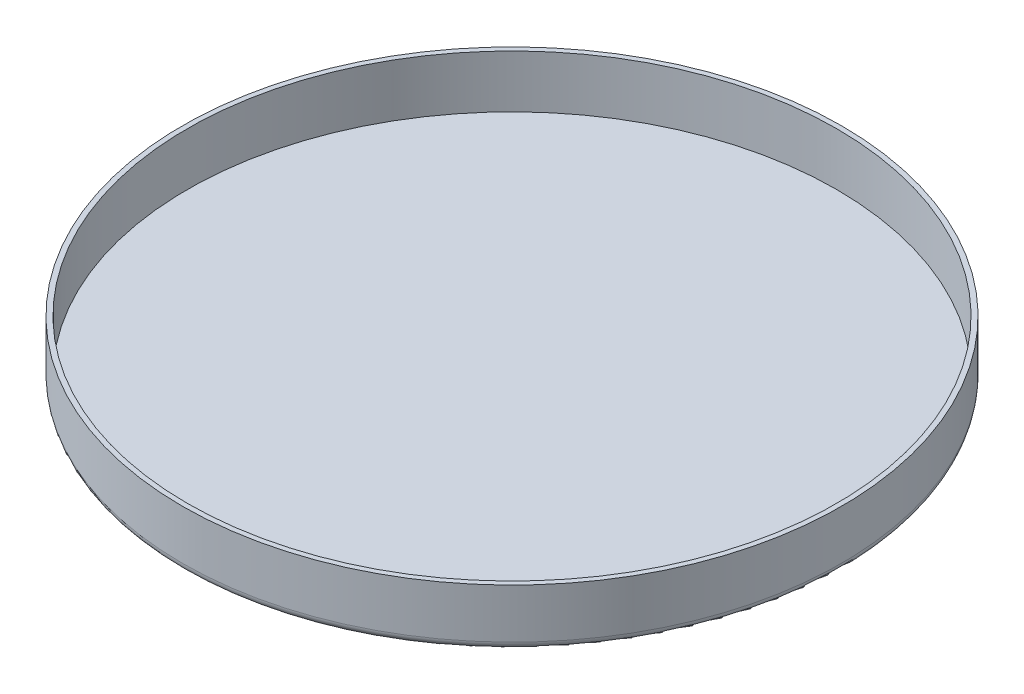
SolidWorks part; units mm, degrees
ref_plane "Plano frontal" through (0, 0, 0) normal (0, 0, 1) x (1, 0, 0)
ref_plane "Plano superior" through (0, 0, 0) normal (0, 1, 0) x (1, 0, 0)
ref_plane "Plano direito" through (0, 0, 0) normal (1, 0, 0) x (0, 0, -1)
sketch "Esboço1" plane through (0, 0, 0) normal (0, 1, 0) x (1, 0, 0)
  circle A0 centre (0, 0) radius 200
extrude "Extrusão1" add sketch "Esboço1" along normal blind 35
shell "Casca1" thickness 3
fillet "Filete1" radius 5 1 edges at (0, 0, 200)
